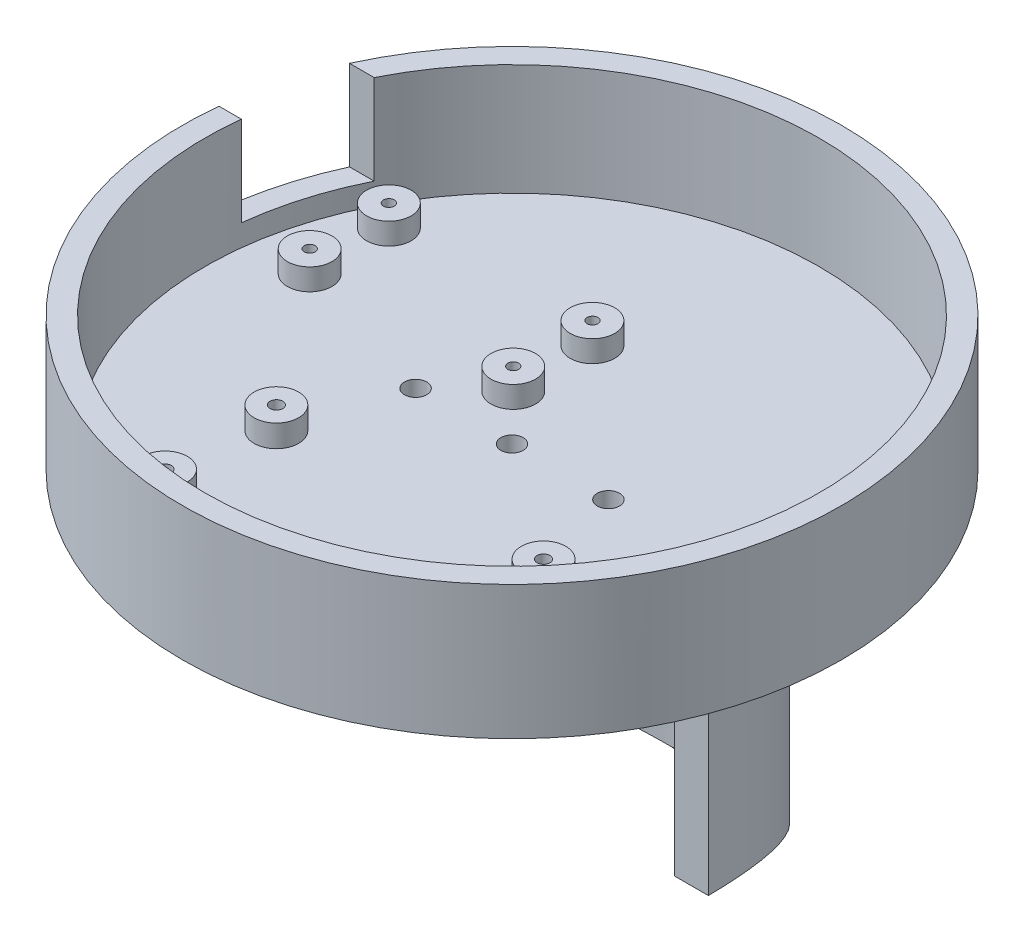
SolidWorks part; units mm, degrees
ref_plane "Front Plane" through (0, 0, 0) normal (0, 0, 1) x (1, 0, 0)
ref_plane "Top Plane" through (0, 0, 0) normal (0, 1, 0) x (1, 0, 0)
ref_plane "Right Plane" through (0, 0, 0) normal (1, 0, 0) x (0, 0, -1)
sketch "Sketch1" plane through (0, 0, 0) normal (0, 1, 0) x (1, 0, 0)
  circle A0 centre (-36.5085, 35.0226) radius 74
  dimension "D1" = 148
extrude "Boss-Extrude1" add sketch "Sketch1" along normal blind 20
sketch "Sketch3" plane through (0, 0, 0) normal (0, -1, 0) x (-1, 0, 0)
  line L0 (-7.5918, 35.0226) -> (0, 35.0226)
  line L1 (73.0169, 35.0226) -> (80.6087, 35.0226)
  arc A0 (-7.5918, 35.0226) -> (80.6087, 35.0226) centre (36.5085, 35.0226) cw
  arc A2 (0, 35.0226) -> (73.0169, 35.0226) centre (36.5085, 35.0226) cw
extrude "Boss-Extrude2" add sketch "Sketch3" along normal blind 70
sketch "Sketch4" plane through (0, -70, 0) normal (0, -1, 0) x (1, 0, 0)
sketch "Sketch5" plane through (0, -70, 0) normal (0, -1, 0) x (1, 0, 0)
sketch "Sketch6" plane through (0, -70, 0) normal (0, -1, 0) x (1, 0, 0)
  line L2 (7.5918, -35.0226) -> (0, -35.0226)
  line L3 (-73.0169, -35.0226) -> (-80.6087, -35.0226)
  line L4 (7.5918, -35.0226) -> (0, -35.0226)
  line L5 (-73.0169, -35.0226) -> (-80.6087, -35.0226)
  arc A2 (-80.6087, -35.0226) -> (7.5918, -35.0226) centre (-36.5085, -35.0226) ccw
  arc A3 (-73.0169, -35.0226) -> (0, -35.0226) centre (-36.5085, -35.0226) ccw
  arc A4 (-80.6087, -35.0226) -> (7.5918, -35.0226) centre (-36.5085, -35.0226) ccw
  arc A5 (-73.0169, -35.0226) -> (0, -35.0226) centre (-36.5085, -35.0226) ccw
  dimension "D1" = 0
extrude "Boss-Extrude3" add sketch "Sketch6" along normal blind 70
hole_wizard "Tap Drill for M6x1.0 Tap1" positions "Sketch11" profile "Sketch12" hole size "M6x1.0" standard "ANSI Metric"
sketch "Sketch11" plane through (0, 0, 0) normal (0, -1, 0) x (-1, 0, 0)
  circle A0 centre (36.5085, 35.0226) radius 74 construction
  point P0 (36.5085, 35.0226)
  point P3 (14.8585, 35.0226)
  point P5 (58.1585, 35.0226)
  dimension "D1" = 0
  dimension "D2" = 21.65
  dimension "D3" = 21.65
sketch "Sketch12" plane through (-36.5085, 0, -35.0226) normal (1, 0, 0) x (0, 0, -1)
  line L0 (0, 0) -> (0, 20)
  line L1 (0, 20) -> (2.5, 20)
  line L2 (2.5, 20) -> (2.5, 0)
  line L5 (2.5, 0) -> (0, 0)
  line L11 (0, -6.35) -> (0, 107.95) construction
  dimension "Thru Hole Dia." = 5
  dimension "Thru Hole Depth" = 20
sketch "Sketch14" plane through (0, 0, 0) normal (1, 0, 0) x (0, 0, -1)
  line L0 (35.0226, -140) -> (35.0226, 0) construction
  line L1 (35.0226, 0) -> (79.1229, 0) construction
  line L3 (35.0226, -113.882) -> (94.6368, -113.882)
  line L4 (35.0226, -113.882) -> (35.0226, -153.6247)
  line L5 (35.0226, -153.6247) -> (94.6368, -153.6247)
  line L6 (94.6368, -113.882) -> (94.6368, -153.6247)
  ellipse E0 centre (35.0226, -100.1249) end of major axis (-15.6111, -101.4624) minor radius 39.3397
  dimension "D1" = 60.7989
  dimension "D2" = 50.6338
extrude "Cut-Extrude7" cut sketch "Sketch14" against normal through all both and the other way through all contours E0 L4 L5 L6 L3 | L4 E0 L3 | L3 E0 L4
sketch "Sketch15" plane through (0, 20, 0) normal (0, 1, 0) x (1, 0, 0)
  circle A0 centre (-36.5085, 35.0226) radius 71.5
extrude "Cut-Extrude8" cut sketch "Sketch15" against normal blind 15
sketch "Sketch17" plane through (0, 20, 0) normal (0, 1, 0) x (1, 0, 0)
sketch "Sketch21" plane through (0, 20, 0) normal (0, 1, 0) x (1, 0, 0)
sketch "Sketch22" plane through (0, 20, 0) normal (0, 1, 0) x (1, 0, 0)
sketch "Sketch23" plane through (0, 5, 0) normal (0, 1, 0) x (1, 0, 0)
  circle A0 centre (-36.5085, 35.0226) radius 71.5
  circle A1 centre (-36.5085, 35.0226) radius 74
extrude "Boss-Extrude10" add sketch "Sketch23" along normal blind 25
sketch3d "3DSketch1"
  line L2 (0, 9.8514, -65.8167) -> (0, 57.8123, -65.8167)
  line L3 (0, 9.8514, -65.8167) -> (0, 9.8514, -42.8167)
  line L4 (0, 9.8514, -42.8167) -> (0, 57.8123, -42.8167)
  line L5 (0, 57.8123, -65.8167) -> (0, 57.8123, -42.8167)
sketch "Sketch30" plane through (0, 5, 0) normal (0, 1, 0) x (1, 0, 0)
  line L1 (-69.0723, 14.6703) -> (-2.0723, 14.6703)
  line L2 (-69.0723, 14.6703) -> (-69.0723, -17.3297)
  line L3 (-69.0723, -17.3297) -> (-2.0723, -17.3297)
  line L4 (-2.0723, 14.6703) -> (-2.0723, -17.3297)
sketch "Sketch33" plane through (0, 5, 0) normal (0, 1, 0) x (1, 0, 0)
  circle A0 centre (-36.5085, 35.0226) radius 71.5
  circle A1 centre (-36.5085, 35.0226) radius 69
extrude "Boss-Extrude12" add sketch "Sketch33" along normal blind 25
sketch "Sketch34" plane through (0, 5, 0) normal (0, 1, 0) x (1, 0, 0)
  line L1 (-94.9893, 42.8167) -> (-43.9893, 42.8167)
  line L2 (-94.9893, 42.8167) -> (-94.9893, 65.8167)
  line L3 (-94.9893, 65.8167) -> (-43.9893, 65.8167)
  line L4 (-43.9893, 42.8167) -> (-43.9893, 65.8167)
  dimension "D1" = 0
extrude "Boss-Extrude13" add sketch "Sketch34" along normal blind 5 contours L2 L1 L4 L3
hole_wizard "#41 (0.096) Diameter Hole1" positions "Sketch35" profile "Sketch36" hole size "#41" standard "ANSI Inch"
sketch "Sketch35" plane through (0, 10, 0) normal (0, 1, 0) x (1, 0, 0)
  line L0 (-94.9893, 65.8167) -> (-43.9893, 65.8167) construction
  line L1 (-94.9893, 42.8167) -> (-94.9893, 65.8167) construction
  point P0 (-92.3493, 63.2067)
  point P2 (-46.6293, 63.2067)
  point P4 (-46.6293, 45.4267)
  point P6 (-92.3493, 45.4267)
  dimension "D1" = 45.72
  dimension "D2" = 45.72
  dimension "D3" = 17.78
  dimension "D4" = 2.61
  dimension "D5" = 2.64
sketch "Sketch36" plane through (-92.3493, 10, -63.2067) normal (1, 0, 0) x (0, 0, 1)
  line L0 (0, 0) -> (0, 5.7326)
  line L1 (0, 5.7326) -> (1.2192, 5)
  line L2 (1.2192, 5) -> (1.2192, 0)
  line L5 (1.2192, 0) -> (0, 0)
  line L10 (0, 5.7326) -> (-1.2192, 5) construction
  line L11 (0, -6.35) -> (0, 107.95) construction
  dimension "Hole Dia." = 2.4384
  dimension "Hole Depth" = 5
  dimension "Drill Angle" = 118
extrude "Cut-Extrude9" cut sketch "3DSketch1" along direction (1, 0, 0) on the side of the normal blind 148 contours L4 L5 L2 L3
sketch "Sketch40" plane through (0, 5, 0) normal (0, 1, 0) x (1, 0, 0)
  line L0 (-69.0723, 14.6703) -> (-2.0723, 14.6703) construction
  line L1 (-69.0723, 14.6703) -> (-69.0723, -17.3297) construction
  line L3 (-2.0723, 14.6703) -> (-2.0723, -17.3297) construction
  line L4 (-69.0723, -17.3297) -> (-2.0723, -17.3297) construction
  circle A0 centre (-65.5723, 11.1703) radius 5
  circle A1 centre (-5.5723, 11.1703) radius 5
  circle A2 centre (-5.5723, -13.8297) radius 5
  circle A3 centre (-65.5723, -13.8297) radius 5
  point P14 (-2.0723, 2.1408)
  dimension "D1" = 3.5
  dimension "D2" = 3.5
  dimension "D3" = 3.5
  dimension "D4" = 3.5
  dimension "D5" = 25
  dimension "D6" = 60
  dimension "D7" = 3.5
  dimension "D8" = 25
  dimension "D9" = 3.5
extrude "Boss-Extrude15" add sketch "Sketch40" along normal blind 5
hole_wizard "#33 (0.113) Diameter Hole1" positions "Sketch41" profile "Sketch43" hole size "#33" standard "ANSI Inch"
sketch "Sketch41" plane through (0, 10, 0) normal (0, 1, 0) x (1, 0, 0)
  point P0 (-65.5723, 11.1703)
  point P3 (-5.5723, 11.1703)
  point P6 (-5.5723, -13.8297)
  point P9 (-65.5723, -13.8297)
sketch "Sketch43" plane through (-65.5723, 10, -11.1703) normal (1, 0, 0) x (0, 0, 1)
  line L0 (0, 0) -> (0, 5.8623)
  line L1 (0, 5.8623) -> (1.4351, 5)
  line L2 (1.4351, 5) -> (1.4351, 0)
  line L5 (1.4351, 0) -> (0, 0)
  line L10 (0, 5.8623) -> (-1.4351, 5) construction
  line L11 (0, -6.35) -> (0, 107.95) construction
  dimension "Hole Dia." = 2.8702
  dimension "Hole Depth" = 5
  dimension "Drill Angle" = 118
sketch "Sketch44" plane through (0, 9.8514, 0) normal (0, 1, 0) x (1, 0, 0)
  circle A0 centre (-92.3493, 63.2067) radius 5
  circle A1 centre (-46.6293, 63.2067) radius 5
  circle A2 centre (-46.6293, 45.4267) radius 5
  circle A3 centre (-92.3493, 45.4267) radius 5
  circle A4 centre (-92.3493, 63.2067) radius 1.2192
  circle A5 centre (-46.6293, 63.2067) radius 1.2192
  circle A6 centre (-46.6293, 45.4267) radius 1.2192
  circle A7 centre (-92.3493, 45.4267) radius 1.2192
extrude "Boss-Extrude17" add sketch "Sketch44" against normal up to surface (4.8514 mm away)
sketch "Sketch45" plane through (0, 9.8514, 0) normal (0, 1, 0) x (1, 0, 0)
  line L0 (-94.9893, 49.6729) -> (-94.9893, 58.9605)
  line L1 (-94.9893, 58.9605) -> (-94.9893, 49.6729)
  line L2 (-88.0846, 65.8167) -> (-50.894, 65.8167)
  line L4 (-50.894, 65.8167) -> (-88.0846, 65.8167)
  line L5 (-43.9893, 58.9605) -> (-43.9893, 49.6729)
  line L6 (-43.9893, 49.6729) -> (-43.9893, 58.9605)
  line L7 (-50.894, 42.8167) -> (-88.0846, 42.8167)
  line L8 (-88.0846, 42.8167) -> (-50.894, 42.8167)
  circle A0 centre (-92.3493, 63.2067) radius 5
  circle A1 centre (-46.6293, 63.2067) radius 5
  circle A2 centre (-46.6293, 45.4267) radius 5
  circle A3 centre (-92.3493, 45.4267) radius 5
extrude "Cut-Extrude14" cut sketch "Sketch45" against normal up to surface (4.8514 mm away) contours A3 A2 A1 A0 M4 M6 M8 M2
